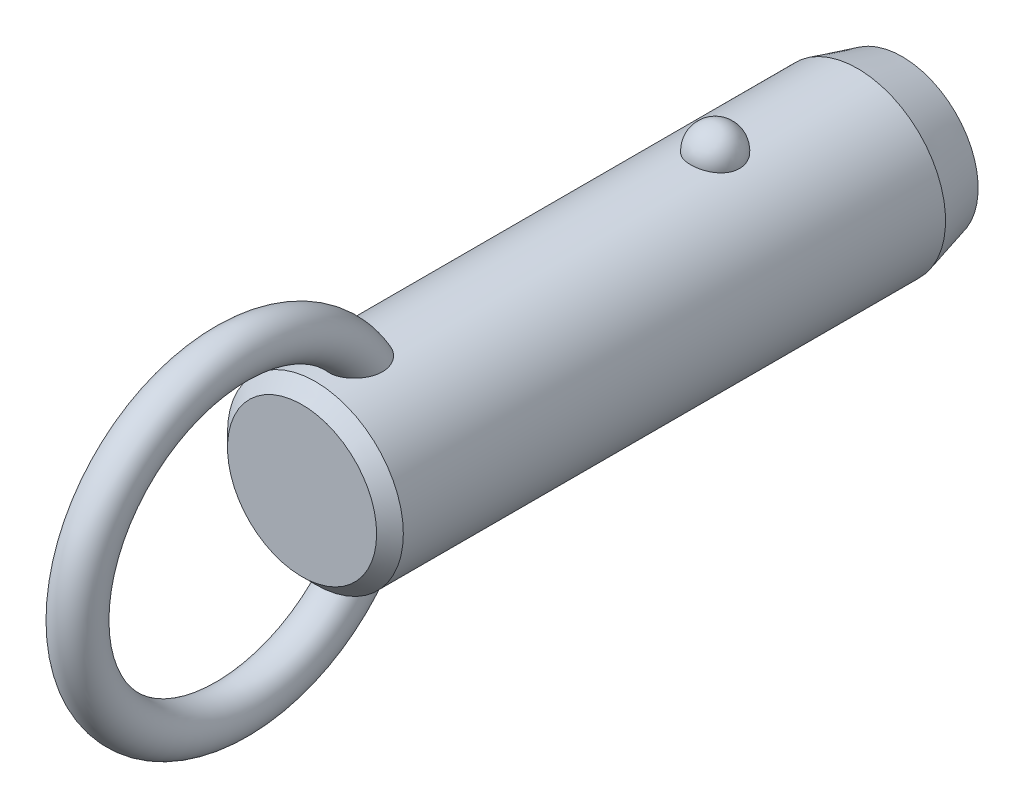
SolidWorks part; units mm, degrees
ref_plane "Front Plane" through (0, 0, 0) normal (0, 0, 1) x (1, 0, 0)
ref_plane "Top Plane" through (0, 0, 0) normal (0, 1, 0) x (1, 0, 0)
ref_plane "Right Plane" through (0, 0, 0) normal (1, 0, 0) x (0, 0, -1)
sketch "Sketch2" plane through (0, 0, 0) normal (0, 0, 1) x (1, 0, 0)
  circle A0 centre (0, 0) radius 7.9
  point P3 (0, 7.9)
  dimension "D1" = 15.8
extrude "Boss-Extrude1" add sketch "Sketch2" along normal blind 25.4
sketch "Sketch3" plane through (0, 0, 0) normal (0, 0, -1) x (-1, 0, 0)
  circle A0 centre (0, 0) radius 7.9
  dimension "D1" = 15.8
extrude "Boss-Extrude2" add sketch "Sketch3" along normal blind 19
chamfer "Chamfer1" distance 4 angle 15 1 edges at (-7.9, 0, -19)
sketch "Sketch12" plane through (0, 0, 0) normal (1, 0, 0) x (0, 0, -1)
  line L0 (-25.4, 7.9) -> (-25.4, -7.9) construction
  point P0 (-25.4, 0)
sketch "Sketch13" plane through (0, 0, 0) normal (1, 0, 0) x (0, 0, -1)
  circle A0 centre (-41.25, 0) radius 15.85
  point P2 (-25.4, 0)
  dimension "D1" = 31.7
sketch "Sketch14" plane through (0, 0, 0) normal (0, 1, 0) x (1, 0, 0)
  circle A0 centre (0, -27.4) radius 2
  point P2 (0, -25.4)
  dimension "D1" = 4
sweep "Sweep1" add profiles "Sketch14" path "Sketch13"
sketch "Sketch15" plane through (0, 0, 25.4) normal (0, 0, 1) x (1, 0, 0)
  circle A0 centre (0, 0) radius 7.9
  dimension "D1" = 15.8
extrude "Boss-Extrude3" add sketch "Sketch15" along normal blind 9.52
chamfer "Chamfer2" distance 1.2 angle 45 1 edges at (7.9, 0, 34.92)
sketch "Sketch18" plane through (0, 0, 0) normal (1, 0, 0) x (0, 0, -1)
  line L0 (15, 7.9) -> (-27.5091, 7.9) construction
  line L1 (2.2, 10.1) -> (2.2, 5.7)
  line L2 (-27.5091, -7.9) -> (15, -7.9) construction
  arc A0 (2.2, 10.1) -> (2.2, 5.7) centre (2.2, 7.9) ccw
  point P4 (0, 7.9)
  dimension "D1" = 18
revolve "Revolve1" add sketch "Sketch18" angle 360 about L1
